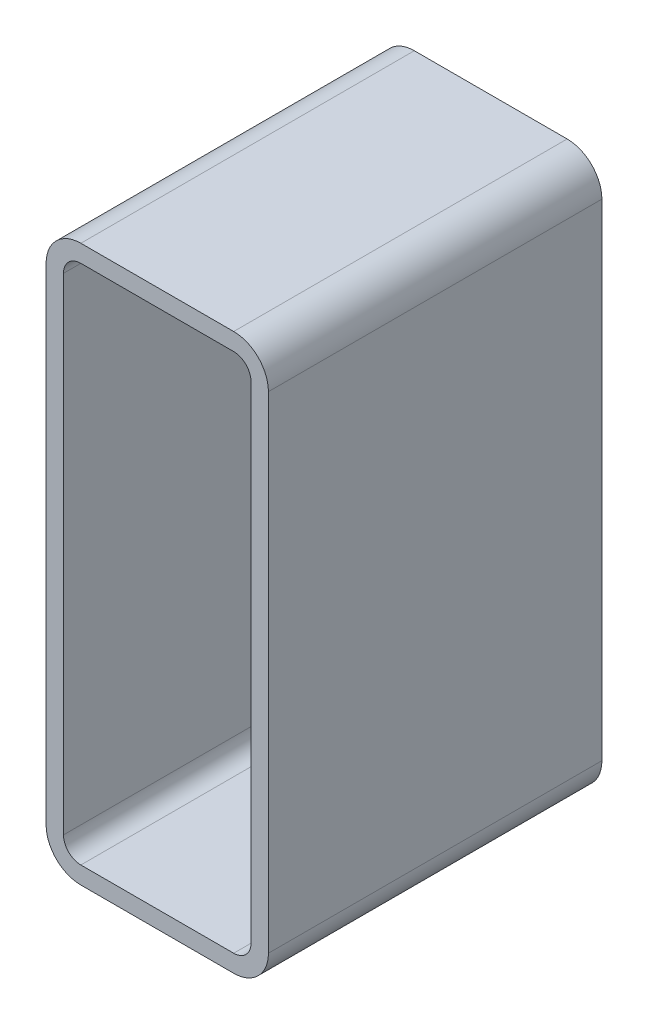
SolidWorks part; units mm, degrees
ref_plane "Front Plane" through (0, 0, 0) normal (0, 0, 1) x (1, 0, 0)
ref_plane "Top Plane" through (0, 0, 0) normal (0, 1, 0) x (1, 0, 0)
ref_plane "Right Plane" through (0, 0, 0) normal (1, 0, 0) x (0, 0, -1)
sketch "Sketch1" plane through (0, 0, 0) normal (0, 0, 1) x (1, 0, 0)
sketch_block_instance "HSS20x8x0.625-1"
sketch_block "HSS20x8x0.625"
extrude "Boss-Extrude1" add sketch "Sketch1" along normal blind 304.8
